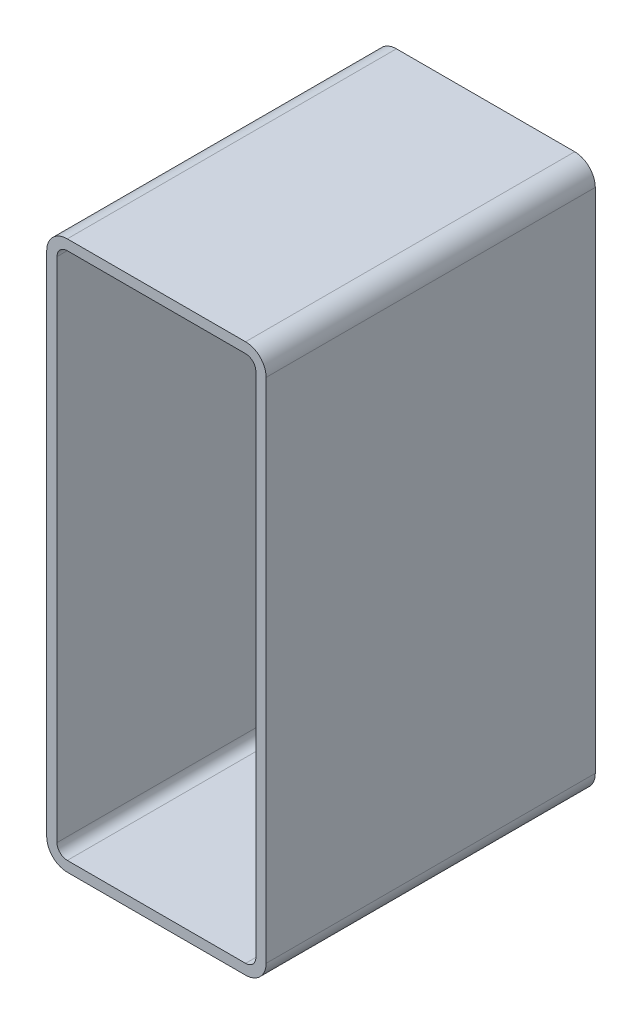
SolidWorks part; units mm, degrees
ref_plane "Front Plane" through (0, 0, 0) normal (0, 0, 1) x (1, 0, 0)
ref_plane "Top Plane" through (0, 0, 0) normal (0, 1, 0) x (1, 0, 0)
ref_plane "Right Plane" through (0, 0, 0) normal (1, 0, 0) x (0, 0, -1)
sketch "Sketch1" plane through (0, 0, 0) normal (0, 0, 1) x (1, 0, 0)
sketch_block_instance "HSS20x8x0.375-1"
sketch_block "HSS20x8x0.375"
extrude "Boss-Extrude1" add sketch "Sketch1" along normal blind 304.8
